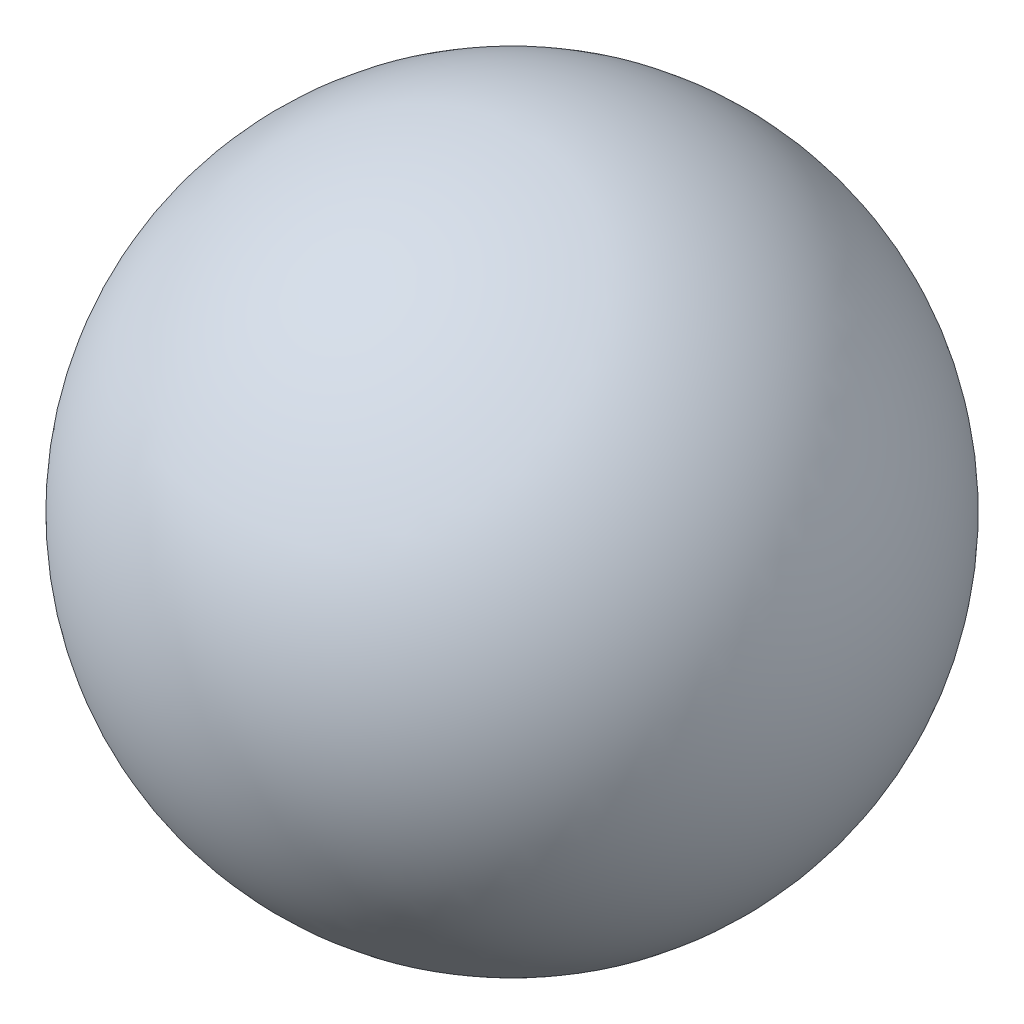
SolidWorks part; units mm, degrees
ref_plane "Front Plane" through (0, 0, 0) normal (0, 0, 1) x (1, 0, 0)
ref_plane "Top Plane" through (0, 0, 0) normal (0, 1, 0) x (1, 0, 0)
ref_plane "Right Plane" through (0, 0, 0) normal (1, 0, 0) x (0, 0, -1)
ref_axis "Axis1" through (0, 21.6535, 0) along (0, -1, 0)
sketch "Sketch1" plane through (0, 0, 0) normal (0, 0, 1) x (1, 0, 0)
  line L0 (0, 19.685) -> (0, -19.685)
  arc A0 (0, -19.685) -> (0, 19.685) centre (0, 0) ccw
  dimension "D1" = 39.37
revolve "Revolve1" add sketch "Sketch1" angle 360 about axis through (0, 21.6535, 0) along (0, -1, 0)
sketch "Sketch2" plane through (0, 0, 0) normal (0, 0, 1) x (1, 0, 0)
  circle A0 centre (0, 0) radius 19.685
